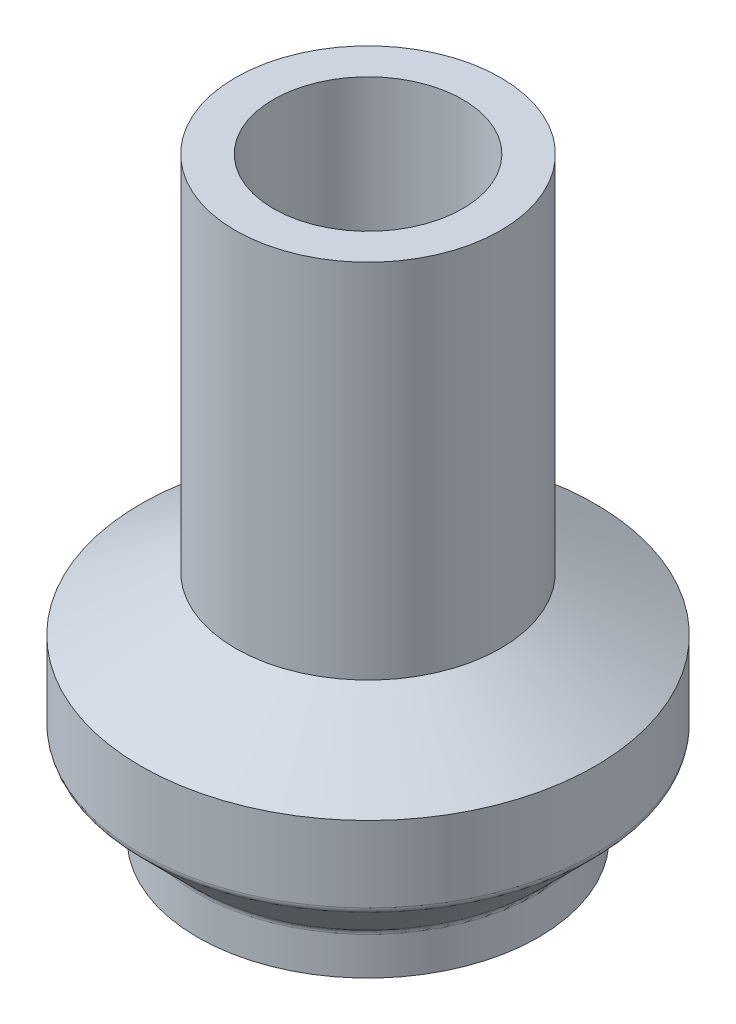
SolidWorks part; units mm, degrees
ref_plane "Plan de face" through (0, 0, 0) normal (0, 0, 1) x (1, 0, 0)
ref_plane "Plan de dessus" through (0, 0, 0) normal (0, 1, 0) x (1, 0, 0)
ref_plane "Plan de droite" through (0, 0, 0) normal (1, 0, 0) x (0, 0, -1)
sketch "Esquisse1" plane through (0, 0, 0) normal (0, 0, 1) x (1, 0, 0)
  line L0 (3.889, 35.2343) -> (3.889, 18.6892) construction
  line L1 (3.889, 35.451) -> (3.889, 14.6468) construction
  line L2 (-0.611, 20.2854) -> (-0.611, 20.1439) construction
  line L3 (-0.611, 19.2854) -> (0.389, 19.2854)
  line L4 (-2.0524, 21.8096) -> (-0.6695, 20.4268) construction
  line L5 (-2.0524, 21.8096) -> (-0.6695, 20.4268)
  line L6 (-2.111, 25.951) -> (-2.111, 21.951) construction
  line L7 (-2.111, 23.951) -> (-2.111, 21.951)
  line L8 (0.389, 27.451) -> (0.389, 25.951) construction
  line L9 (0.389, 34.951) -> (0.389, 25.3944)
  line L10 (0.389, 25.3944) -> (-2.111, 23.951)
  line L11 (0.389, 34.951) -> (1.389, 34.951)
  line L12 (1.389, 34.951) -> (1.389, 29.951)
  line L13 (1.389, 29.951) -> (3.889, 29.951)
  line L14 (9.389, 35.451) -> (-1.611, 35.451) construction
  line L15 (-0.611, 20.2854) -> (-0.611, 19.2854)
  line L16 (0.889, 19.2854) -> (3.889, 19.2854)
  line L17 (3.889, 19.2854) -> (3.889, 29.951)
  line L18 (0.389, 19.2854) -> (0.389, 23.2854)
  line L19 (0.389, 23.2854) -> (0.889, 23.2854)
  line L20 (0.889, 19.2854) -> (0.889, 23.2854)
  arc A0 (-2.111, 21.951) -> (-2.0524, 21.8096) centre (-1.911, 21.951) ccw construction
  arc A1 (-2.111, 21.951) -> (-2.0524, 21.8096) centre (-1.911, 21.951) ccw
  arc A2 (-0.611, 20.2854) -> (-0.6695, 20.4268) centre (-0.811, 20.2854) ccw construction
  arc A3 (-0.611, 20.2854) -> (-0.6695, 20.4268) centre (-0.811, 20.2854) ccw
  dimension "D1" = 5
  dimension "D2" = 5
  dimension "D3" = 0.5
  dimension "D4" = 2
  dimension "D5" = 60
  dimension "D6" = 1
  dimension "D7" = 0.5
  dimension "D8" = 4
  dimension "D9" = 7
revolve "Révolution1" add sketch "Esquisse1" angle 360 about L0
sketch "Esquisse2" plane through (0, 29.951, 0) normal (0, 1, 0) x (-1, 0, 0)
  line L0 (-3.889, -2.9296) -> (-3.889, 3.5) construction
  line L1 (-6.6076, 0) -> (-1.096, 0) construction
  circle A0 centre (-3.8766, -1.5) radius 0.5
  circle A1 centre (-3.8766, 1.5) radius 0.5
  circle A2 centre (-3.889, 0) radius 3.5 construction
  dimension "D1" = 1
  dimension "D2" = 1
  dimension "D4" = 1.5
  dimension "D3" = 1.5
extrude "Enlèv. mat.-Extru.1" cut sketch "Esquisse2" against normal through all
